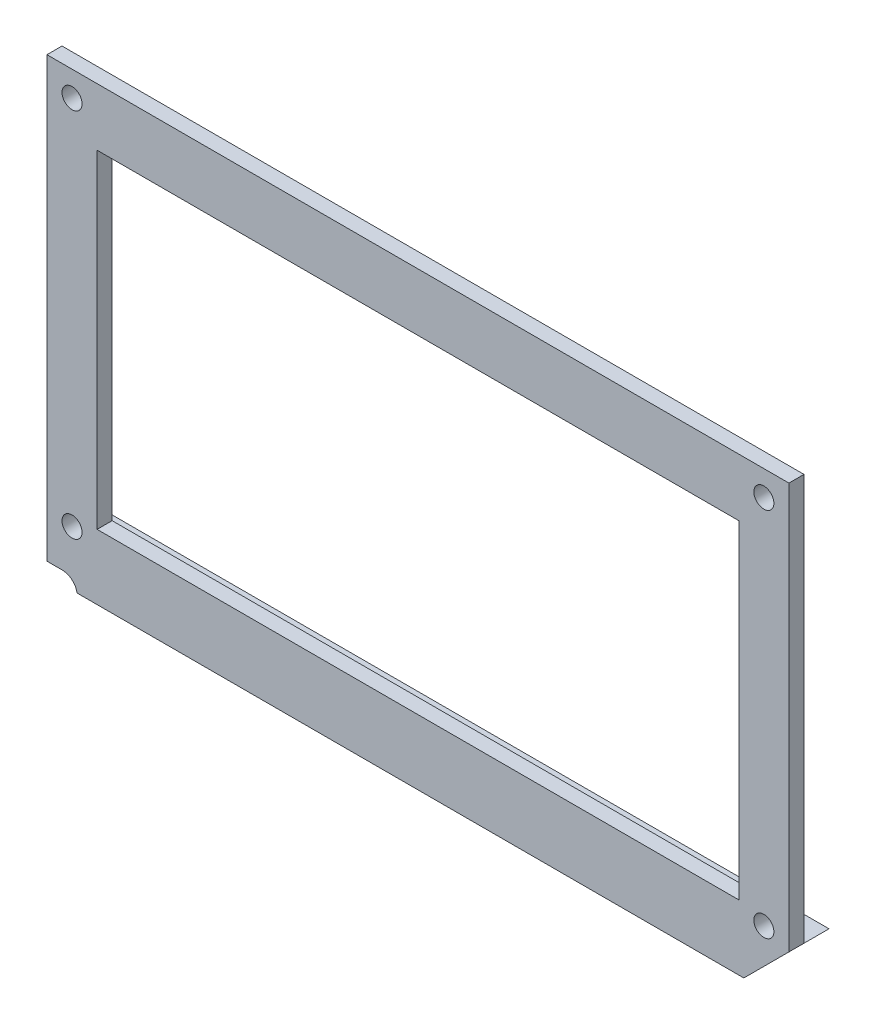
SolidWorks part; units mm, degrees
ref_plane "Front Plane" through (0, 0, 0) normal (0, 0, 1) x (1, 0, 0)
ref_plane "Top Plane" through (0, 0, 0) normal (0, 1, 0) x (1, 0, 0)
ref_plane "Right Plane" through (0, 0, 0) normal (1, 0, 0) x (0, 0, -1)
sketch "Sketch1" plane through (0, 0, 0) normal (0, 1, 0) x (1, 0, 0)
  line L1 (-64, 32.75) -> (64, 32.75)
  line L2 (-64, 32.75) -> (-64, -32.75)
  line L3 (-64, -32.75) -> (64, -32.75)
  line L4 (64, 32.75) -> (64, -32.75)
  line L5 (-64, 32.75) -> (64, -32.75) construction
  line L6 (-64, -32.75) -> (64, 32.75) construction
  line L7 (-69, 34.75) -> (69, 34.75) construction
  line L8 (-69, 34.75) -> (-69, -39.25) construction
  line L9 (-69, -39.25) -> (69, -39.25) construction
  line L10 (69, 34.75) -> (69, -39.25) construction
  line L11 (-69, 34.75) -> (69, -39.25) construction
  line L12 (-69, -39.25) -> (69, 34.75) construction
  line L13 (-74, 45.75) -> (74, 45.75)
  line L14 (-74, 45.75) -> (-74, -44.25)
  line L15 (-74, -44.25) -> (74, -44.25)
  line L16 (74, 45.75) -> (74, -44.25)
  line L17 (-74, 45.75) -> (74, -44.25) construction
  line L18 (-74, -44.25) -> (74, 45.75) construction
  circle A0 centre (-69, 34.75) radius 2
  circle A1 centre (69, 34.75) radius 2
  circle A2 centre (69, -39.25) radius 2
  circle A3 centre (-69, -39.25) radius 2
  point P0 (0, 0)
  point P5 (0, -2.25)
  point P15 (0, 0.75)
  dimension "D7" = 4
  dimension "D1" = 128
  dimension "D2" = 65.5
  dimension "D3" = 138
  dimension "D4" = 74
  dimension "D5" = 2
  dimension "D6" = 5
  dimension "D8" = 90
  dimension "D9" = 11
  dimension "D10" = 5
  dimension "D11" = 5
extrude "Boss-Extrude1" add sketch "Sketch1" along normal blind 3
sketch "Sketch2" plane through (0, 3, 0) normal (0, 1, 0) x (1, 0, 0)
  line L0 (74, -44.25) -> (74, 45.75) construction
  line L1 (-74, 45.75) -> (74, 45.75)
  line L2 (-74, 45.75) -> (-74, 41.75)
  line L3 (-74, 41.75) -> (74, 41.75)
  line L4 (74, 45.75) -> (74, 41.75)
  dimension "D1" = 4
extrude "Boss-Extrude2" add sketch "Sketch2" along normal blind 10
sketch "Sketch3" plane through (0, 0, -45.75) normal (0, 0, -1) x (-1, 0, 0)
  line L0 (48, 8) -> (-57, 8) construction
  line L1 (-74, 13) -> (74, 13) construction
  line L2 (74, 13) -> (74, 0) construction
  circle A0 centre (48, 8) radius 2.15
  circle A1 centre (-57, 8) radius 2.15
  dimension "D3" = 4.3
  dimension "D1" = 105
  dimension "D2" = 5
  dimension "D4" = 26
extrude "Cut-Extrude1" cut sketch "Sketch3" against normal up to next
sketch "Sketch5" plane through (0, 0, -45.75) normal (0, 0, -1) x (-1, 0, 0)
  line L0 (-74, 13) -> (74, 13) construction
  line L1 (74, 0) -> (68, 0)
  line L2 (74, 0) -> (74, 13)
  line L3 (74, 13) -> (68, 13)
  line L4 (68, 0) -> (68, 13)
  dimension "D1" = 6
extrude "Cut-Extrude2" cut sketch "Sketch5" against normal blind 2.5
sketch "Sketch6" plane through (0, 0, 0) normal (1, 0, 0) x (0, 0, -1)
  line L0 (41.75, 3) -> (41.75, 6)
  line L1 (41.75, 13) -> (41.75, 3) construction
  line L3 (-44.25, 3) -> (41.75, 3) construction
  line L4 (38.75, 3) -> (41.75, 3)
  arc A0 (41.75, 6) -> (38.75, 3) centre (38.75, 6) cw
  dimension "D1" = 3
extrude "Boss-Extrude3" add sketch "Sketch6" along normal mid plane 80
sketch "Sketch7" plane through (0, 3, 0) normal (0, 1, 0) x (1, 0, 0)
  circle A0 centre (-40, 38.75) radius 3
  circle A1 centre (40, 38.75) radius 3
  dimension "D1" = 6
extrude "Cut-Extrude3" cut sketch "Sketch7" along normal up to next
chamfer "Chamfer1" distance 9 angle 45 1 edges at (74, 6.5, -45.75)
fillet "Fillet1" radius 3 1 edges at (-68, 6.5, -43.25)
move or copy body "Body-Move/Copy1" bodies to move or copy 106 copy no rotation origin (0, 6.5, -0.75) rotation axis (-1, 0, 0) rotation angle 90
